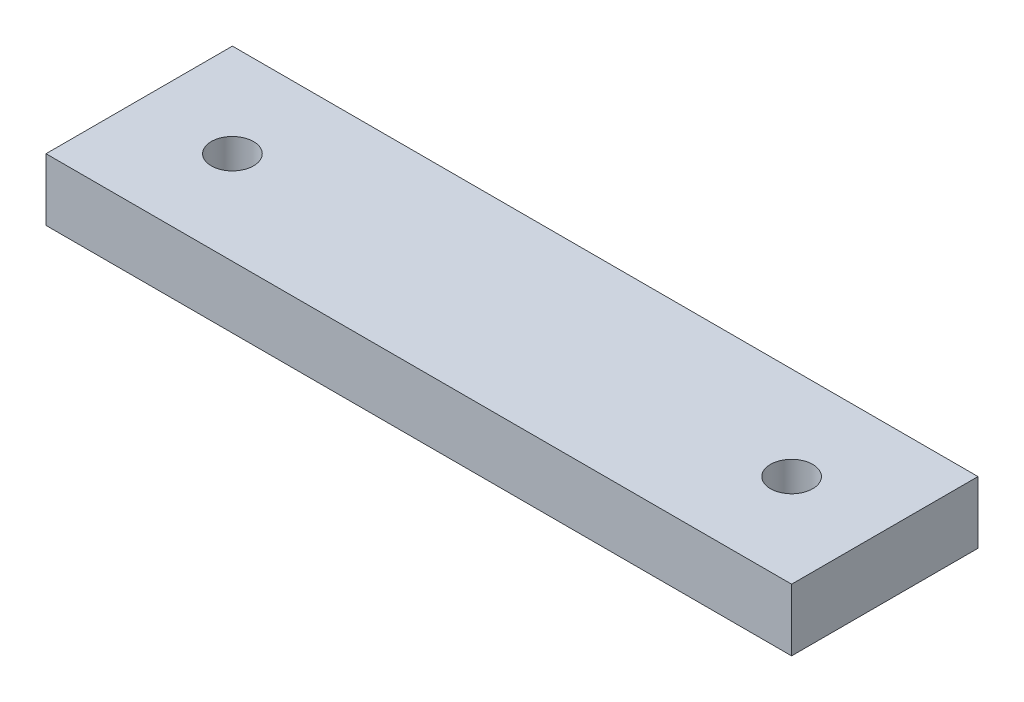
SolidWorks part; units mm, degrees
ref_plane "Plan de face" through (0, 0, 0) normal (0, 0, 1) x (1, 0, 0)
ref_plane "Plan de dessus" through (0, 0, 0) normal (0, 1, 0) x (1, 0, 0)
ref_plane "Plan de droite" through (0, 0, 0) normal (1, 0, 0) x (0, 0, -1)
sketch "Esquisse1" plane through (0, 0, 0) normal (0, 1, 0) x (1, 0, 0)
  line L1 (-60, -15) -> (60, -15)
  line L2 (-60, -15) -> (-60, 15)
  line L3 (-60, 15) -> (60, 15)
  line L4 (60, -15) -> (60, 15)
  point P4 (0, -15)
  point P7 (-60, 0)
  dimension "D1" = 30
  dimension "D2" = 120
extrude "Extrusion1" add sketch "Esquisse1" along normal blind 10
hole_wizard "Trou taraudé M81" positions "Esquisse3" profile "Esquisse4" tap size "M8" standard "ISO"
sketch "Esquisse3" plane through (0, 10, 0) normal (0, 1, 0) x (-1, 0, 0)
  point P0 (45, 0)
  point P1 (-45, 0)
  dimension "D1" = 45
  dimension "D2" = 90
sketch "Esquisse4" plane through (-45, 10, 0) normal (1, 0, 0) x (0, 0, 1)
  line L0 (0, 0) -> (0, 10)
  line L1 (0, 10) -> (3.4, 10)
  line L2 (3.4, 10) -> (3.4, 0)
  line L5 (3.4, 0) -> (0, 0)
  line L11 (0, -6.35) -> (0, 107.95) construction
  dimension "Diamètre du trou pour taraudage jusqu'au prochain" = 6.8
  dimension "Profondeur du trou pour taraudage jusqu'au prochain" = 10
